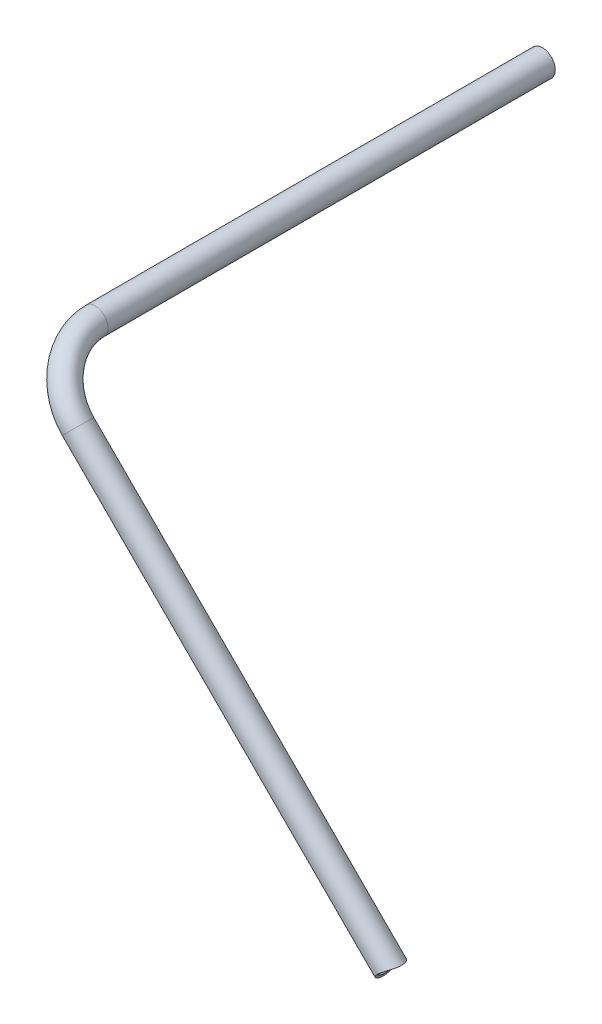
SolidWorks part; units mm, degrees
ref_plane "Front" through (0, 0, 0) normal (0, 0, 1) x (1, 0, 0)
ref_plane "Top" through (0, 0, 0) normal (0, 1, 0) x (1, 0, 0)
ref_plane "Side" through (0, 0, 0) normal (1, 0, 0) x (0, 0, -1)
sketch "PipeSketch"
  dimension "OuterDiameter" = 26.67
  dimension "InnerDiameter" = 20.9296
extrude "Extrusion" add sketch "PipeSketch" along normal blind 464.3663
sketch "FilterSketch" plane through (0, 0, 0) normal (0, 0, 1) x (1, 0, 0)
  circle A0 centre (0, 0) radius 9.525 construction
  dimension "NominalDiameter" = 19.05
sketch "Sketch1" plane through (0, 0, 464.3663) normal (0, 0, 1) x (1, 0, 0)
  line L0 (43.1052, -43.1052) -> (86.2105, 0) construction
  circle A0 centre (0, 0) radius 13.335 construction
  circle A1 centre (0, 0) radius 10.4648 construction
  circle A2 centre (0, 0) radius 13.335
  circle A3 centre (0, 0) radius 10.4648
revolve "Revolve1" add sketch "Sketch1" angle 90 about L0
sketch "Sketch2" plane through (43.1052, -43.1052, 0) normal (0.7071, -0.7071, 0) x (0.7071, 0.7071, 0)
  circle A0 centre (0, 525.3263) radius 10.4648 construction
  circle A1 centre (0, 525.3263) radius 13.335 construction
  circle A2 centre (0, 525.3263) radius 10.4648
  circle A3 centre (0, 525.3263) radius 13.335
extrude "Extrude1" add sketch "Sketch2" along normal blind 488.5154
sketch "Sketch3" plane through (388.5378, -388.5378, 0) normal (0.7071, -0.7071, 0) x (0, 0, -1)
  circle A0 centre (-525.3263, 0) radius 13.335 construction
  circle A1 centre (-525.3263, 0) radius 13.335
extrude "Cut-Extrude1" cut sketch "Sketch3" against normal up to surface
